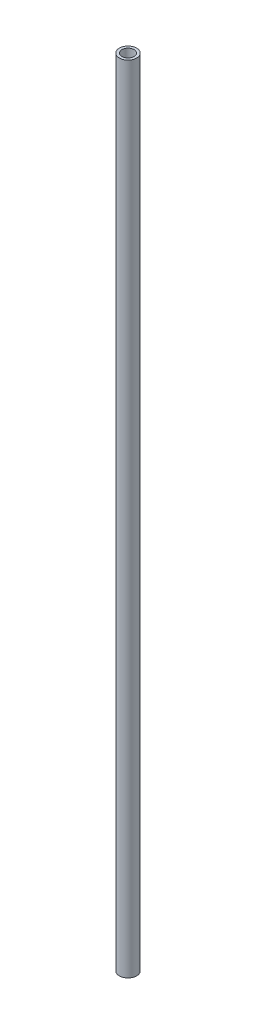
SolidWorks part; units mm, degrees
ref_plane "Front Plane" through (0, 0, 0) normal (0, 0, 1) x (1, 0, 0)
ref_plane "Top Plane" through (0, 0, 0) normal (0, 1, 0) x (1, 0, 0)
ref_plane "Right Plane" through (0, 0, 0) normal (1, 0, 0) x (0, 0, -1)
sketch "Sketch1" plane through (0, 0, 0) normal (0, 1, 0) x (1, 0, 0)
  circle A0 centre (0, 0) radius 1.25
  circle A1 centre (0, 0) radius 0.875
  dimension "D1" = 2.5
  dimension "D2" = 1.75
extrude "Boss-Extrude1" add sketch "Sketch1" along normal blind 115
